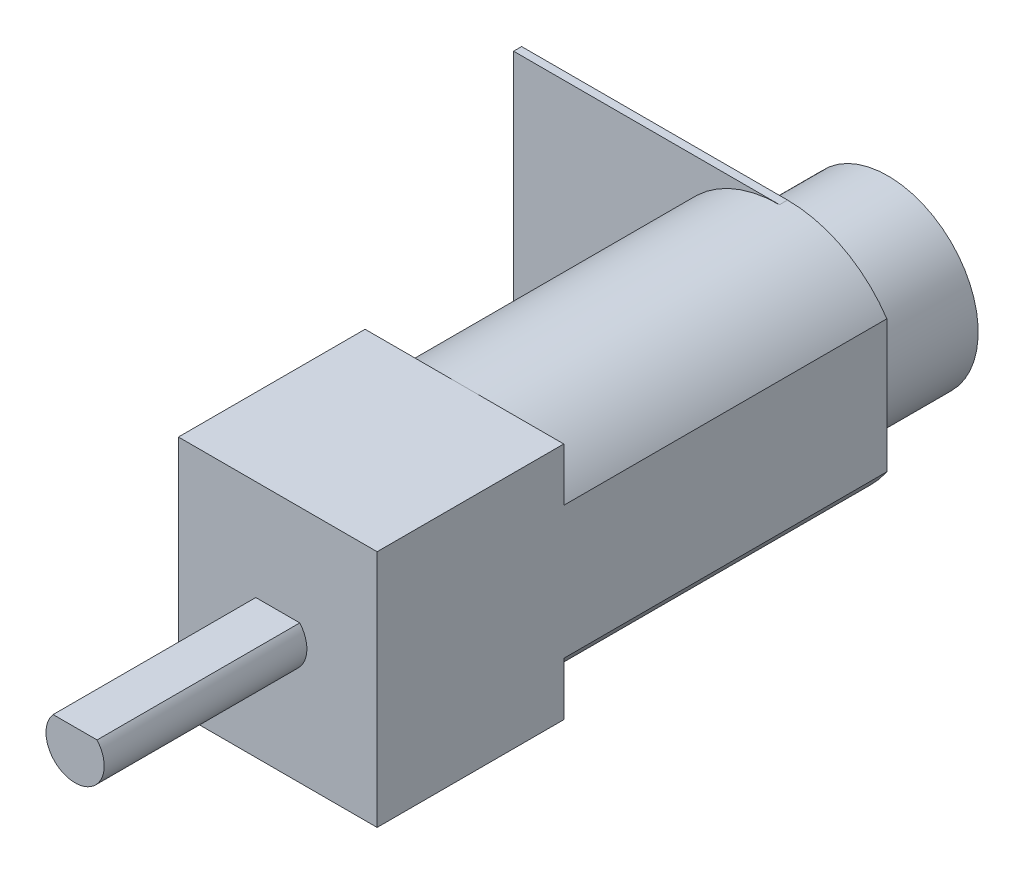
SolidWorks part; units mm, degrees
ref_plane "前视基准面" through (0, 0, 0) normal (0, 0, 1) x (1, 0, 0)
ref_plane "上视基准面" through (0, 0, 0) normal (0, 1, 0) x (1, 0, 0)
ref_plane "右视基准面" through (0, 0, 0) normal (1, 0, 0) x (0, 0, -1)
sketch "草图1" plane through (0, 0, 0) normal (0, 0, 1) x (1, 0, 0)
  line L1 (4.95, -5.95) -> (-4.95, -5.95)
  line L2 (4.95, -5.95) -> (4.95, 5.95)
  line L3 (4.95, 5.95) -> (-4.95, 5.95)
  line L4 (-4.95, -5.95) -> (-4.95, 5.95)
  line L5 (4.95, -5.95) -> (-4.95, 5.95) construction
  line L6 (4.95, 5.95) -> (-4.95, -5.95) construction
  point P0 (0, 0)
  dimension "D1" = 9.9
  dimension "D2" = 11.9
extrude "凸台-拉伸1" add sketch "草图1" along normal blind 9.3
sketch "草图2" plane through (0, 0, 0) normal (0, 0, -1) x (-1, 0, 0)
  line L1 (4.95, -5.95) -> (-4.95, -5.95)
  line L2 (4.95, -5.95) -> (4.95, 5.95)
  line L3 (4.95, 5.95) -> (-4.95, 5.95)
  line L4 (-4.95, -5.95) -> (-4.95, 5.95)
  line L5 (4.95, -5.95) -> (-4.95, 5.95) construction
  line L6 (4.95, 5.95) -> (-4.95, -5.95) construction
  circle A0 centre (0, 0) radius 5.95
  dimension "D1" = 11.9
extrude "凸台-拉伸2" add sketch "草图2" along normal blind 15.7 contours L2 A0 L4
sketch "草图3" plane through (0, 0, -15.7) normal (0, 0, -1) x (-1, 0, 0)
  line L1 (13.25, 5.95) -> (-4.95, 5.95)
  line L3 (4.95, -3.3015) -> (4.95, 3.3015)
  line L6 (13.25, 5.95) -> (13.25, -5.95)
  line L7 (13.25, -5.95) -> (-4.95, -5.95)
  line L8 (-4.95, 5.95) -> (-4.95, -5.95)
  line L9 (13.25, 5.95) -> (-4.95, -5.95) construction
  line L10 (13.25, -5.95) -> (-4.95, 5.95) construction
  line L11 (4.95, -3.3015) -> (4.95, 3.3015)
  line L12 (-4.95, 3.3015) -> (-4.95, -3.3015)
  line L13 (-4.95, 3.3015) -> (-4.95, -3.3015)
  arc A2 (4.95, 3.3015) -> (-4.95, 3.3015) centre (0, 0) ccw
  arc A3 (-4.95, -3.3015) -> (4.95, -3.3015) centre (0, 0) ccw
  arc A4 (4.95, 3.3015) -> (-4.95, 3.3015) centre (0, 0) ccw
  arc A6 (-4.95, -3.3015) -> (4.95, -3.3015) centre (0, 0) ccw
  point P2 (4.15, 0)
  point P5 (4.7621, -5.95)
  dimension "D2" = 18.2
  dimension "D1" = 0
extrude "凸台-拉伸3" add sketch "草图3" along normal blind 0.4 contours M9 M6 M7 M8 | L7 L6 L1 M7 M6 M9
sketch "草图4" plane through (0, 0, -16.1) normal (0, 0, -1) x (-1, 0, 0)
  circle A0 centre (0, 0) radius 4.5
  dimension "D1" = 9
extrude "凸台-拉伸4" add sketch "草图4" along normal blind 5
sketch "草图5" plane through (0, 0, 9.3) normal (0, 0, 1) x (1, 0, 0)
  line L0 (-1.0954, 0.95) -> (1.0954, 0.95)
  circle A0 centre (0, 0) radius 1.45
  dimension "D1" = 2.9
  dimension "D2" = 0.95
extrude "凸台-拉伸5" add sketch "草图5" along normal blind 10.1 contours L0 A0
